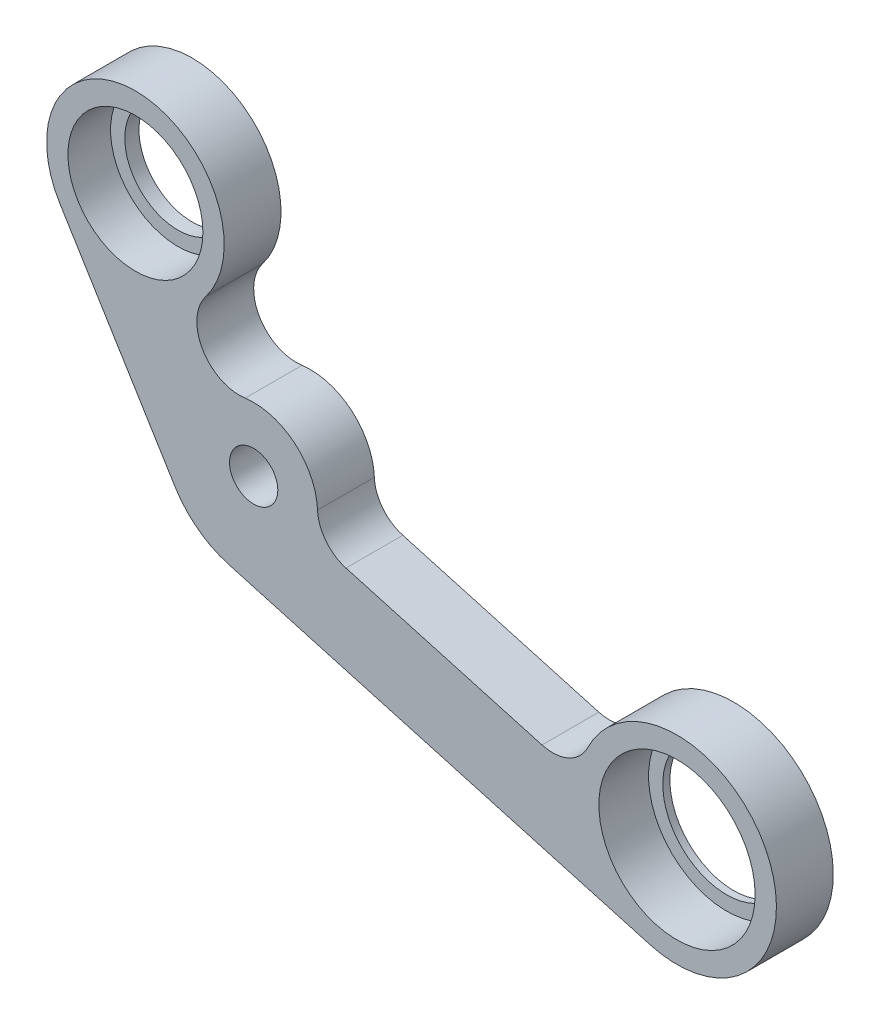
SolidWorks part; units mm, degrees
ref_plane "Face" through (0, 0, 0) normal (0, 0, 1) x (1, 0, 0)
ref_plane "Dessus" through (0, 0, 0) normal (0, 1, 0) x (1, 0, 0)
ref_plane "Droite" through (0, 0, 0) normal (1, 0, 0) x (0, 0, -1)
imported_body "Importée1"
sketch "Esquisse1" plane through (0, 0, -17) normal (0, 0, 1) x (1, 0, 0)
  circle A0 centre (-42.4575, 230.0601) radius 4 construction
  circle A1 centre (-42.4575, 230.0601) radius 4
extrude "Extrusion1" add sketch "Esquisse1" against normal through all
hole_wizard "Trou taraudé M8x1.251" positions "Esquisse3" profile "Esquisse2" tap size "M8x1.25" standard "ISO"
sketch "Esquisse3" plane through (0, 0, -17) normal (0, 0, 1) x (1, 0, 0)
  arc A0 (-33.4651, 230.4301) -> (-43.6552, 238.9801) centre (-42.4575, 230.0601) ccw construction
  point P0 (-42.4575, 230.0601)
sketch "Esquisse2" plane through (-42.4575, 230.0601, -17) normal (1, 0, 0) x (0, -1, 0)
  line L0 (0, 0) -> (0, 8)
  line L1 (0, 8) -> (3.4, 8)
  line L2 (3.4, 8) -> (3.4, 0)
  line L5 (3.4, 0) -> (0, 0)
  line L11 (0, -6.35) -> (0, 107.95) construction
  dimension "Diamètre du trou pour taraudage jusqu'au prochain" = 6.8
  dimension "Profondeur du trou pour taraudage jusqu'au prochain" = 8
